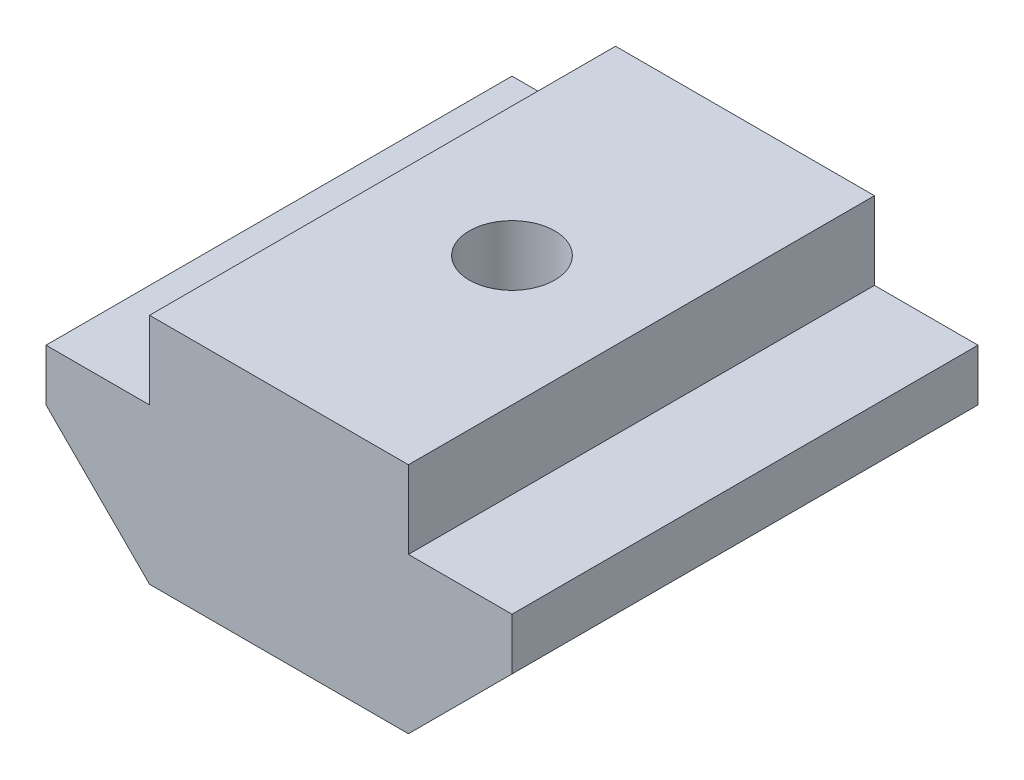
SolidWorks part; units mm, degrees
ref_plane "前视基准面" through (0, 0, 0) normal (0, 0, 1) x (1, 0, 0)
ref_plane "上视基准面" through (0, 0, 0) normal (0, 1, 0) x (1, 0, 0)
ref_plane "右视基准面" through (0, 0, 0) normal (1, 0, 0) x (0, 0, -1)
sketch "草图1" plane through (0, 0, 0) normal (0, 0, 1) x (1, 0, 0)
  line L0 (0, 0) -> (4, 0)
  line L1 (4, 0) -> (4, 3)
  line L2 (4, 3) -> (14, 3)
  line L3 (14, 3) -> (14, 0)
  line L4 (14, 0) -> (18, 0)
  line L5 (18, 0) -> (18, -2)
  line L6 (18, -2) -> (14, -6)
  line L7 (14, -6) -> (4, -6)
  line L8 (4, -6) -> (0, -2)
  line L9 (0, -2) -> (0, 0)
  dimension "D1" = 6
  dimension "D2" = 4
  dimension "D3" = 4
  dimension "D4" = 4
  dimension "D5" = 10
  dimension "D6" = 9
  dimension "D7" = 10
  dimension "D8" = 18
  dimension "D9" = 4
extrude "拉伸1" add sketch "草图1" along normal blind 18
hole_wizard "M4 螺纹孔1" positions "3D草图1" profile "草图2" tap size "M4" standard "GB"
sketch3d "3D草图1"
  line L0 (14, 3, 18) -> (14, 3, 0) construction
  point P0 (9, 3, 9)
  dimension "D1" = 5
  dimension "D2" = 9
sketch "草图2" plane through (9, 3, 9) normal (1, 0, 0) x (0, 0, 1)
  line L0 (0, 0) -> (0, 9)
  line L1 (0, 9) -> (1.65, 9)
  line L2 (1.65, 9) -> (1.65, 0)
  line L5 (1.65, 0) -> (0, 0)
  line L11 (0, -6.35) -> (0, 107.95) construction
  dimension "籵謂蹟恇謂郰芛眻噤" = 3.3
  dimension "籵謂蹟恇謂郰芛旮僅" = 9
